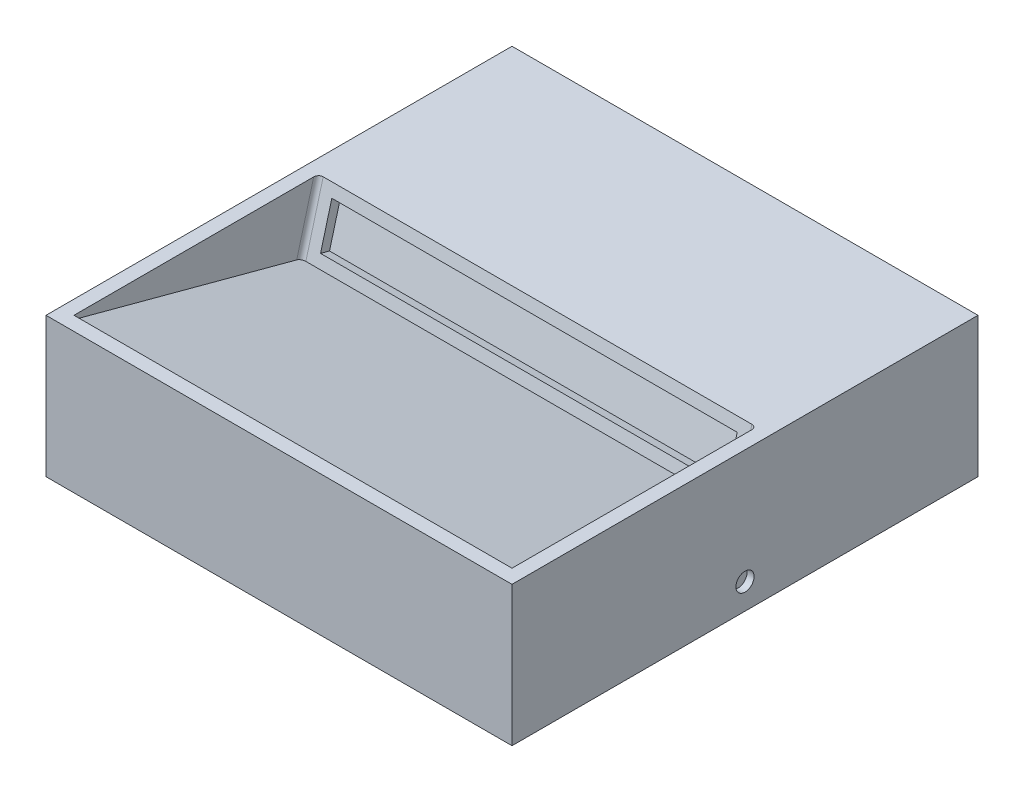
SolidWorks part; units mm, degrees
ref_plane "Alzado" through (0, 0, 0) normal (0, 0, 1) x (1, 0, 0)
ref_plane "Planta" through (0, 0, 0) normal (0, 1, 0) x (1, 0, 0)
ref_plane "Vista lateral" through (0, 0, 0) normal (1, 0, 0) x (0, 0, -1)
sketch "Croquis1" plane through (0, 0, 0) normal (0, 1, 0) x (1, 0, 0)
  line L0 (0, 0) -> (0, 100)
  line L1 (0, 100) -> (100, 100)
  line L2 (100, 100) -> (100, 0)
  line L3 (100, 0) -> (0, 0)
  dimension "D1" = 100
  dimension "D2" = 100
extrude "Saliente-Extruir1" add sketch "Croquis1" along normal blind 30
ref_plane "Plano1" through (0, 27.9904, -7.5) normal (0, 0.9659, -0.2588) x (1, 0, 0)
sketch "Croquis3" plane through (0, 27.9904, -7.5) normal (0, 0.9659, -0.2588) x (1, 0, 0)
  line L1 (50, 88.828) -> (50, 45.828) construction
  line L2 (3, 88.828) -> (3, -7.7646)
  line L3 (3, 44.828) -> (3, -7.7646)
  line L4 (100, 88.828) -> (0, 88.828) construction
  line L5 (97, 44.828) -> (97, -7.7646)
  line L6 (4, 45.828) -> (96, 45.828)
  line L7 (3, -7.7646) -> (97, -7.7646)
  arc A0 (97, 44.828) -> (96, 45.828) centre (96, 44.828) ccw
  arc A1 (4, 45.828) -> (3, 44.828) centre (4, 44.828) ccw
  point P11 (50, 45.828)
  dimension "D2" = 1
  dimension "D3" = 43
  dimension "D1" = 3
extrude "Cortar-Extruir1" cut sketch "Croquis3" along normal blind 34 contours L6 A1 L3 L7 L5 A0
sketch "Croquis4" plane through (0, -11.8612, -44.2665) normal (0, 0.2588, 0.9659) x (1, 0, 0)
  line L8 (6.5, 40.8379) -> (6.5, 31.4778)
  line L9 (6.5, 31.4778) -> (93.5, 31.4778)
  line L10 (93.5, 31.4778) -> (93.5, 40.8379)
  line L11 (93.5, 40.8379) -> (6.5, 40.8379)
  line L12 (6.5, 40.8379) -> (6.5, 31.4778)
  line L13 (6.5, 31.4778) -> (93.5, 31.4778)
  line L14 (93.5, 31.4778) -> (93.5, 40.8379)
  line L15 (93.5, 40.8379) -> (6.5, 40.8379)
  dimension "D1" = 2.5
extrude "Cortar-Extruir2" cut sketch "Croquis4" against normal blind 2
sketch "Croquis5" plane through (0, 0, 0) normal (0, -1, 0) x (1, 0, 0)
  line L4 (96.5, -1.5) -> (3.5, -1.5)
  line L5 (1.5, -3.5) -> (1.5, -96.5)
  line L6 (3.5, -98.5) -> (96.5, -98.5)
  line L7 (98.5, -96.5) -> (98.5, -3.5)
  line L8 (97.5, -2.5) -> (2.5, -2.5)
  line L9 (2.5, -2.5) -> (2.5, -97.5)
  line L10 (2.5, -97.5) -> (97.5, -97.5)
  line L11 (97.5, -97.5) -> (97.5, -2.5)
  line L12 (96.5, -2.5) -> (3.5, -2.5)
  line L13 (2.5, -3.5) -> (2.5, -96.5)
  line L14 (3.5, -97.5) -> (96.5, -97.5)
  line L15 (97.5, -96.5) -> (97.5, -3.5)
  arc A0 (2.5, -96.5) -> (3.5, -97.5) centre (3.5, -96.5) ccw
  arc A1 (97.5, -96.5) -> (96.5, -97.5) centre (96.5, -96.5) cw
  arc A2 (97.5, -3.5) -> (96.5, -2.5) centre (96.5, -3.5) ccw
  arc A3 (2.5, -3.5) -> (3.5, -2.5) centre (3.5, -3.5) cw
  arc A4 (1.5, -3.5) -> (3.5, -1.5) centre (3.5, -3.5) cw
  arc A5 (1.5, -96.5) -> (3.5, -98.5) centre (3.5, -96.5) ccw
  arc A6 (98.5, -96.5) -> (96.5, -98.5) centre (96.5, -96.5) cw
  arc A7 (98.5, -3.5) -> (96.5, -1.5) centre (96.5, -3.5) ccw
  dimension "D2" = 1
  dimension "D1" = 2.5
  dimension "D3" = 1
extrude "Cortar-Extruir3" cut sketch "Croquis5" against normal blind 15
sketch "Croquis6" plane through (0, 0, 0) normal (-1, 0, 0) x (0, 0, 1)
  line L0 (-50, 0) -> (-50, 3.5) construction
  line L1 (-100, 0) -> (0, 0) construction
  line L2 (-50, 3.5) -> (-50, 5.5) construction
  circle A0 centre (-50, 5.5) radius 2
  dimension "D1" = 4
  dimension "D2" = 3.5
hole_wizard "Taladro de margen para M3.51" positions "Croquis3D1" profile "Croquis7" hole size "M3.5" standard "DIN"
sketch3d "Croquis3D1"
  point P0 (0, 5.5, -50)
sketch "Croquis7" plane through (0, 5.5, -50) normal (0, 1, 0) x (0, 0, 1)
  line L0 (0, 0) -> (0, 97.5)
  line L1 (0, 97.5) -> (1.95, 97.5)
  line L2 (1.95, 97.5) -> (1.95, 0)
  line L5 (1.95, 0) -> (0, 0)
  line L11 (0, -6.35) -> (0, 107.95) construction
  dimension "Diámetro de taladro hasta el siguiente" = 3.9
  dimension "Profundidad de taladro hasta el siguiente" = 97.5
ref_plane "Plano3" through (50, 0, 0) normal (-1, 0, 0) x (0, 0, 1)
mirror "Simetría1" about plane through (50, 0, 0) normal (-1, 0, 0) of "Taladro de margen para M3.51"
sketch "Croquis11" plane through (0, 30, 0) normal (0, 1, 0) x (1, 0, 0)
  line L7 (3, 3) -> (3, 0)
  line L8 (3, 3) -> (97, 3)
  line L9 (3, 3) -> (97, 3)
  line L10 (3, 0) -> (97, 0)
  line L11 (97, 0) -> (97, 3)
  dimension "D1" = 3
extrude "Saliente-Extruir2" add sketch "Croquis11" against normal up to surface (0.8038 mm away)
